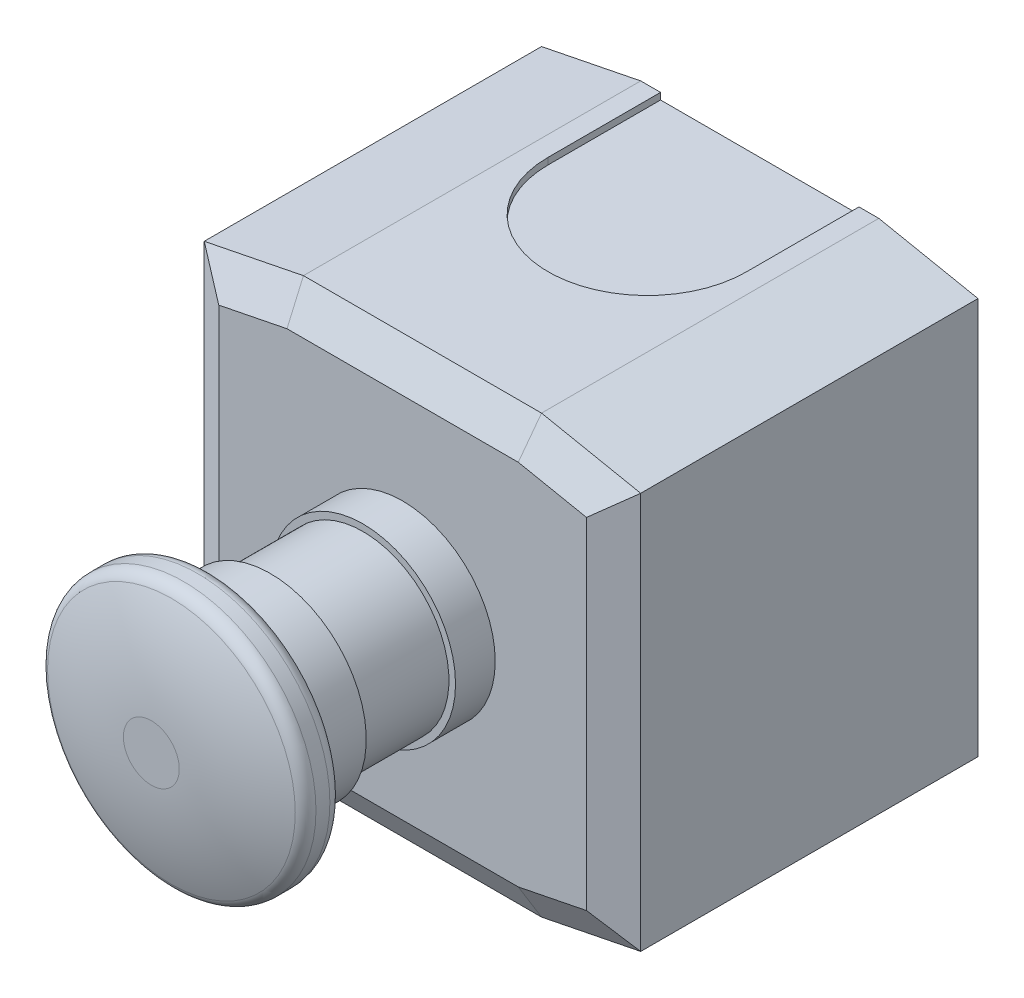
SolidWorks part; units mm, degrees
ref_plane "Plan de face" through (0, 0, 0) normal (0, 0, 1) x (1, 0, 0)
ref_plane "Plan de dessus" through (0, 0, 0) normal (0, 1, 0) x (1, 0, 0)
ref_plane "Plan de droite" through (0, 0, 0) normal (1, 0, 0) x (0, 0, -1)
sketch "Esquisse1" plane through (0, 0, 0) normal (0, 0, 1) x (1, 0, 0)
  line L0 (-18, 33) -> (-33, 30)
  line L1 (-18, 33) -> (18, 33)
  line L2 (-33, 30) -> (-33, -30)
  line L3 (-18, -33) -> (18, -33)
  line L4 (33, 30) -> (33, -30)
  line L5 (18, 33) -> (33, 30)
  line L6 (-18, -33) -> (-33, -30)
  line L7 (18, -33) -> (33, -30)
  dimension "D1" = 66
  dimension "D2" = 15
  dimension "D3" = 33
  dimension "D4" = 33
  dimension "D5" = 3
  dimension "D6" = 15
  dimension "D7" = 3
  dimension "D8" = 3
  dimension "D9" = 15
  dimension "D10" = 15
  dimension "D11" = 3
  dimension "D12" = 66
extrude "Extrusion1" add sketch "Esquisse1" along normal blind 54
chamfer "Chanfrein1" distance 3 angle 60 8 edges at (25.5, 31.5, 54) (33, 0, 54) (25.5, -31.5, 54) (0, -33, 54) (-25.5, -31.5, 54) (-33, 0, 54) (-25.5, 31.5, 54) (0, 33, 54)
sketch "Esquisse2" plane through (0, -33, 0) normal (0, -1, 0) x (1, 0, 0)
  line L0 (0, 0) -> (0, 33.8435) construction
  line L1 (15, 17) -> (15, 0)
  line L2 (-18, 0) -> (18, 0) construction
  line L3 (15, 0) -> (-15, 0)
  line L4 (-15, 0) -> (-15, 17)
  arc A0 (15, 17) -> (-15, 17) centre (0, 17) ccw
  dimension "D1" = 30
  dimension "D2" = 17
extrude "Enlèv. mat.-Extru.1" cut sketch "Esquisse2" against normal blind 1
mirror "Symétrie1" about plane through (0, 0, 0) normal (0, 1, 0) of "Enlèv. mat.-Extru.1"
sketch "Esquisse4" plane through (0, 0, 0) normal (1, 0, 0) x (0, 0, -1)
  line L0 (0, 0) -> (-103.6266, 0) construction
  line L1 (-54, 14) -> (-60, 14)
  line L2 (-54, -25.7402) -> (-54, 25.7402) construction
  line L3 (-60, 14) -> (-60, 13)
  line L4 (-60, 13) -> (-74, 13)
  line L5 (-74, 13) -> (-74, 14.5)
  line L6 (-74, 14.5) -> (-83, 14.5)
  line L7 (-83, 14.5) -> (-83, 18)
  line L8 (-85, 20) -> (-87.1028, 20)
  line L9 (-92, 4.2254) -> (-92, 0)
  line L10 (-92, 0) -> (-54, 0)
  line L11 (-54, 0) -> (-54, 14)
  arc A0 (-92, 4.2254) -> (-88.9648, 18.73) centre (-47.5471, 2.4932) cw
  arc A1 (-85, 20) -> (-83, 18) centre (-85, 18) cw
  arc A2 (-88.9648, 18.73) -> (-87.1028, 20) centre (-87.1028, 18) cw
  dimension "D9" = 2
  dimension "D1" = 38
  dimension "D2" = 6
  dimension "D3" = 14
  dimension "D4" = 9
  dimension "D5" = 40
  dimension "D6" = 29
  dimension "D7" = 26
  dimension "D8" = 28
revolve "Révolution1" add sketch "Esquisse4" angle 360 about L0
sketch "Esquisse5" plane through (0, 0, 0) normal (0, 0, -1) x (-1, 0, 0)
  circle A0 centre (-27, 0) radius 2.15
  circle A1 centre (27, 0) radius 2.15
  dimension "D3" = 4.3
  dimension "D4" = 4.3
  dimension "D1" = 54
  dimension "D2" = 27
extrude "Enlèv. mat.-Extru.2" cut sketch "Esquisse5" against normal blind 10
